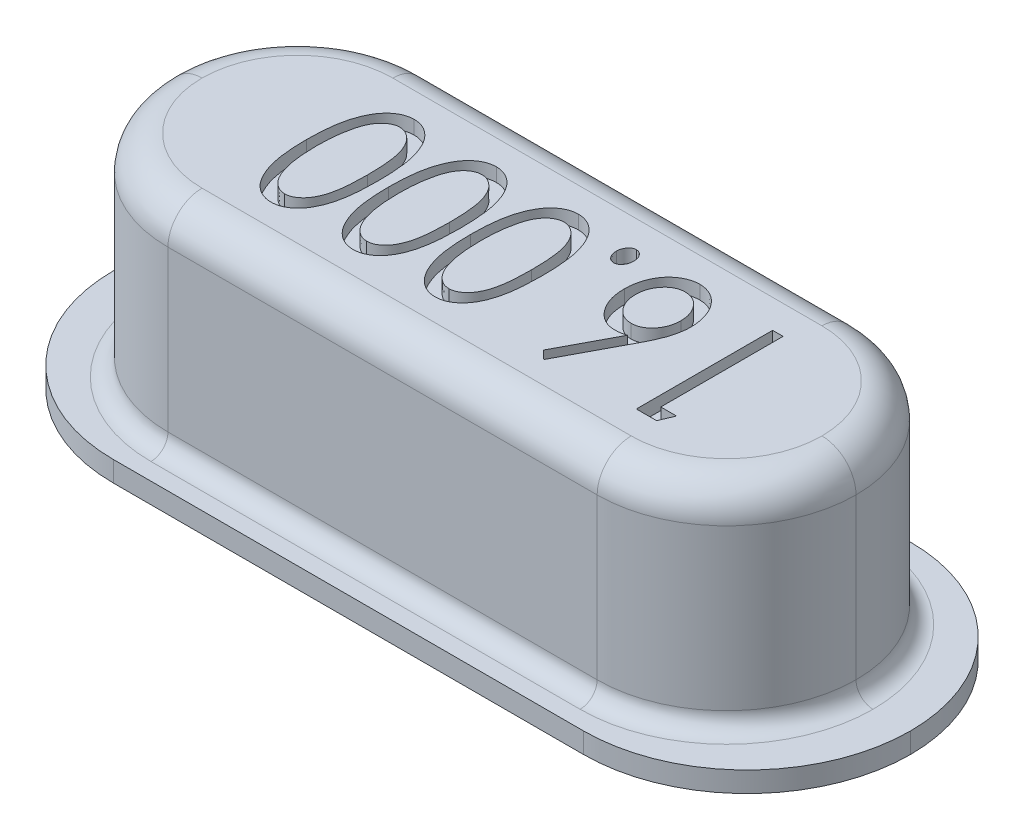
SolidWorks part; units mm, degrees
ref_plane "Plano frontal" through (0, 0, 0) normal (0, 0, 1) x (1, 0, 0)
ref_plane "Plano superior" through (0, 0, 0) normal (0, 1, 0) x (1, 0, 0)
ref_plane "Plano direito" through (0, 0, 0) normal (1, 0, 0) x (0, 0, -1)
sketch "Esboço1" plane through (0, 0, 0) normal (0, 1, 0) x (1, 0, 0)
  line L0 (-5.85, 2.4) -> (5.85, -2.4) construction
  line L1 (-5.85, 2.4) -> (5.85, 2.4)
  line L2 (-5.85, 2.4) -> (-5.85, -2.4)
  line L3 (-5.85, -2.4) -> (5.85, -2.4)
  line L4 (5.85, 2.4) -> (5.85, -2.4)
  dimension "D1" = 11.7
  dimension "D2" = 4.8
extrude "Extrusão1" add sketch "Esboço1" along normal blind 0.3
fillet "Filete1" radius 2.4 4 edges at (-5.85, 0.15, 2.4) (-5.85, 0.15, -2.4) (5.85, 0.15, -2.4) (5.85, 0.15, 2.4)
sketch "Esboço7" plane through (0, 0, 0) normal (0, -1, 0) x (1, 0, 0)
  line L0 (-5.85, 0) -> (5.85, 0) construction
  line L1 (-2.55, -0.3) -> (-2.55, 0.3) construction
  line L2 (-2.7, 0.3) -> (-2.4, 0.3)
  line L3 (-2.7, 0.3) -> (-2.7, -0.3)
  line L4 (-2.7, -0.3) -> (-2.4, -0.3)
  line L5 (-2.4, 0.3) -> (-2.4, -0.3)
  line L6 (2.4, 0.3) -> (2.7, 0.3)
  line L7 (2.4, 0.3) -> (2.4, -0.3)
  line L8 (2.4, -0.3) -> (2.7, -0.3)
  line L9 (2.7, 0.3) -> (2.7, -0.3)
  line L10 (2.55, -0.3) -> (2.55, 0.3) construction
  point P12 (-2.4, 0)
  point P13 (2.7, 0)
  dimension "D1" = 0.3
  dimension "D2" = 0.3
  dimension "D3" = 0.6
  dimension "D4" = 0.6
  dimension "D5" = 3.3
  dimension "D6" = 3.3
extrude "Extrusão2" add sketch "Esboço7" along normal blind 0.6
sketch "Esboço8" plane through (-2.7, 0, 0) normal (-1, 0, 0) x (0, 0, 1)
  line L0 (0.3, -0.6) -> (-0.3, -0.6) construction
  line L1 (-0.3, -0.3) -> (0.3, -0.3)
  line L2 (-0.3, -0.3) -> (-0.3, -0.6)
  line L3 (-0.3, -0.6) -> (0.3, -0.6)
  line L4 (0.3, -0.3) -> (0.3, -0.6)
  line L5 (-0.3, -0.6) -> (-0.3, 0) construction
  line L6 (0.3, -0.6) -> (0.3, 0) construction
  dimension "D1" = 0.3
extrude "Extrusão3" add sketch "Esboço8" along normal blind 3.55
sketch "Esboço9" plane through (2.7, 0, 0) normal (1, 0, 0) x (0, 0, -1)
  line L0 (0.3, -0.6) -> (-0.3, -0.6) construction
  line L1 (-0.3, -0.3) -> (0.3, -0.3)
  line L2 (-0.3, -0.3) -> (-0.3, -0.6)
  line L3 (-0.3, -0.6) -> (0.3, -0.6)
  line L4 (0.3, -0.3) -> (0.3, -0.6)
  line L5 (-0.3, -0.6) -> (-0.3, 0) construction
  line L6 (0.3, -0.6) -> (0.3, 0) construction
  dimension "D1" = 0.3
extrude "Extrusão4" add sketch "Esboço9" along normal blind 3.55
fillet "Filete2" radius 0.3 2 edges at (-2.4, -0.6, 0) (2.4, -0.6, 0)
sketch "Esboço11" plane through (0, 0.3, 0) normal (0, 1, 0) x (1, 0, 0)
  line L0 (-5.85, 0) -> (5.85, 0) construction
  line L2 (-5.05, 1.9) -> (5.05, 1.9)
  line L3 (-5.05, 1.9) -> (-5.05, -1.9)
  line L4 (-5.05, -1.9) -> (5.05, -1.9)
  line L5 (5.05, 1.9) -> (5.05, -1.9)
  point P8 (5.05, 0)
  point P9 (0, 1.9)
  dimension "D1" = 10.1
  dimension "D2" = 3.8
extrude "Extrusão5" add sketch "Esboço11" along normal blind 3.1
fillet "Filete3" radius 1.9 4 edges at (-5.05, 1.85, -1.9) (-5.05, 1.85, 1.9) (5.05, 1.85, 1.9) (5.05, 1.85, -1.9)
fillet "Filete4" radius 0.25 6 edges at (-4.4935, 0.3, 1.3435) (-4.4935, 0.3, -1.3435) (0, 0.3, -1.9) (4.4935, 0.3, -1.3435) (4.4935, 0.3, 1.3435) (0, 0.3, 1.9)
fillet "Filete5" radius 0.5 6 edges at (4.4935, 3.4, -1.3435) (4.4935, 3.4, 1.3435) (0, 3.4, 1.9) (-4.4935, 3.4, 1.3435) (-4.4935, 3.4, -1.3435) (0, 3.4, -1.9)
sketch "Esboço12" plane through (0, 3.4, 0) normal (0, 1, 0) x (1, 0, 0)
  text T0 "SMU 4" font "Century Gothic" height 1.5
extrude "Extrusão6" cut sketch "Esboço12" against normal blind 0.1
sketch "Croquis1" plane through (0, 3.4, 0) normal (0, 1, 0) x (-1, 0, 0)
  line L0 (3.15, -1.4) -> (-3.15, -1.4)
  line L1 (3.15, 1.4) -> (-3.15, 1.4)
  arc A0 (3.15, 1.4) -> (3.15, -1.4) centre (3.15, 0) cw
  arc A1 (-3.15, -1.4) -> (-3.15, 1.4) centre (-3.15, 0) cw
extrude "Saliente-Extruir1" add sketch "Croquis1" against normal blind 1
sketch "Croquis2" plane through (0, 3.4, 0) normal (0, 1, 0) x (-1, 0, 0)
  text T0 "16.000" font "Century Gothic" height 2
extrude "Cortar-Extruir1" cut sketch "Croquis2" against normal blind 0.2
sketch "Croquis3" plane through (0, -0.6, 0) normal (0, -1, 0) x (1, 0, 0)
  line L1 (-6.25, 0.3) -> (6.25, 0.3)
  line L2 (-6.25, 0.3) -> (-6.25, -0.3)
  line L3 (-6.25, -0.3) -> (6.25, -0.3)
  line L4 (6.25, 0.3) -> (6.25, -0.3)
extrude "Cortar-Extruir2" cut sketch "Croquis3" against normal blind 0.5
sketch "Croquis4" plane through (0, -0.1, 0) normal (0, -1, 0) x (1, 0, 0)
  line L0 (2.7, -0.3) -> (2.7, 0.3) construction
  line L1 (-2.7, 0.3) -> (-2.4, 0.3)
  line L2 (-2.7, 0.3) -> (-2.7, -0.3)
  line L3 (-2.7, -0.3) -> (-2.4, -0.3)
  line L4 (-2.4, 0.3) -> (-2.4, -0.3)
  line L5 (2.4, 0.3) -> (2.7, 0.3)
  line L6 (2.4, 0.3) -> (2.4, -0.3)
  line L7 (2.4, -0.3) -> (2.7, -0.3)
  line L8 (2.7, 0.3) -> (2.7, -0.3)
extrude "Saliente-Extruir2" add sketch "Croquis4" along normal blind 1
